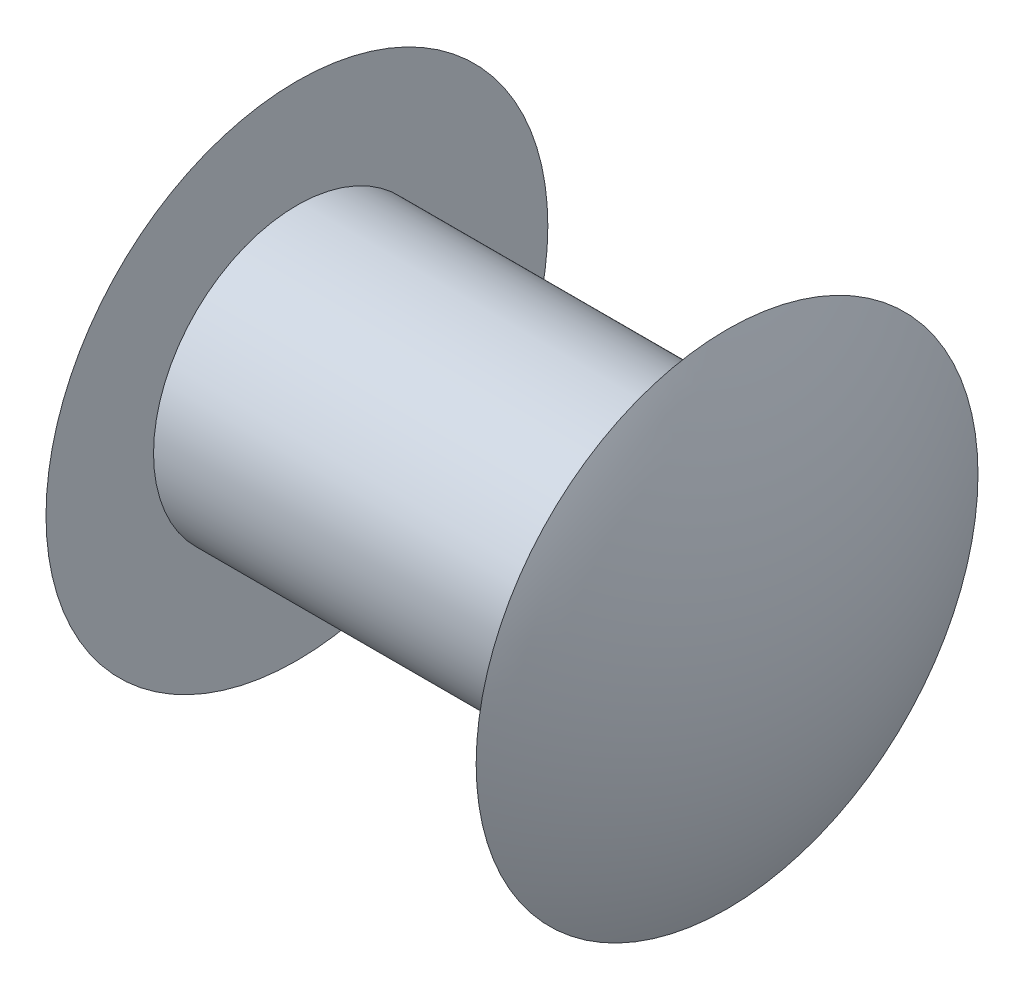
SolidWorks part; units mm, degrees
ref_plane "Front Plane" through (0, 0, 0) normal (0, 0, 1) x (1, 0, 0)
ref_plane "Top Plane" through (0, 0, 0) normal (0, 1, 0) x (1, 0, 0)
ref_plane "Right Plane" through (0, 0, 0) normal (1, 0, 0) x (0, 0, -1)
sketch "Sketch1" plane through (0, 0, 0) normal (0, 0, 1) x (1, 0, 0)
  line L0 (0, 0) -> (23.5422, 0) construction
  line L1 (0, 3.175) -> (9.525, 3.175)
  line L2 (0, 5.5562) -> (0, 3.175)
  line L3 (9.525, 5.5562) -> (9.525, 3.175)
  line L4 (-1.27, 0) -> (10.795, 0)
  arc A0 (0, 5.5562) -> (-1.27, 0) centre (11.5193, 0) ccw
  arc A1 (9.525, 5.5562) -> (10.795, 0) centre (-1.9943, 0) cw
  dimension "D1" = 6.35
  dimension "D2" = 9.525
  dimension "D3" = 11.1125
  dimension "D4" = 1.27
revolve "Revolve1" add sketch "Sketch1" angle 360 about L4
